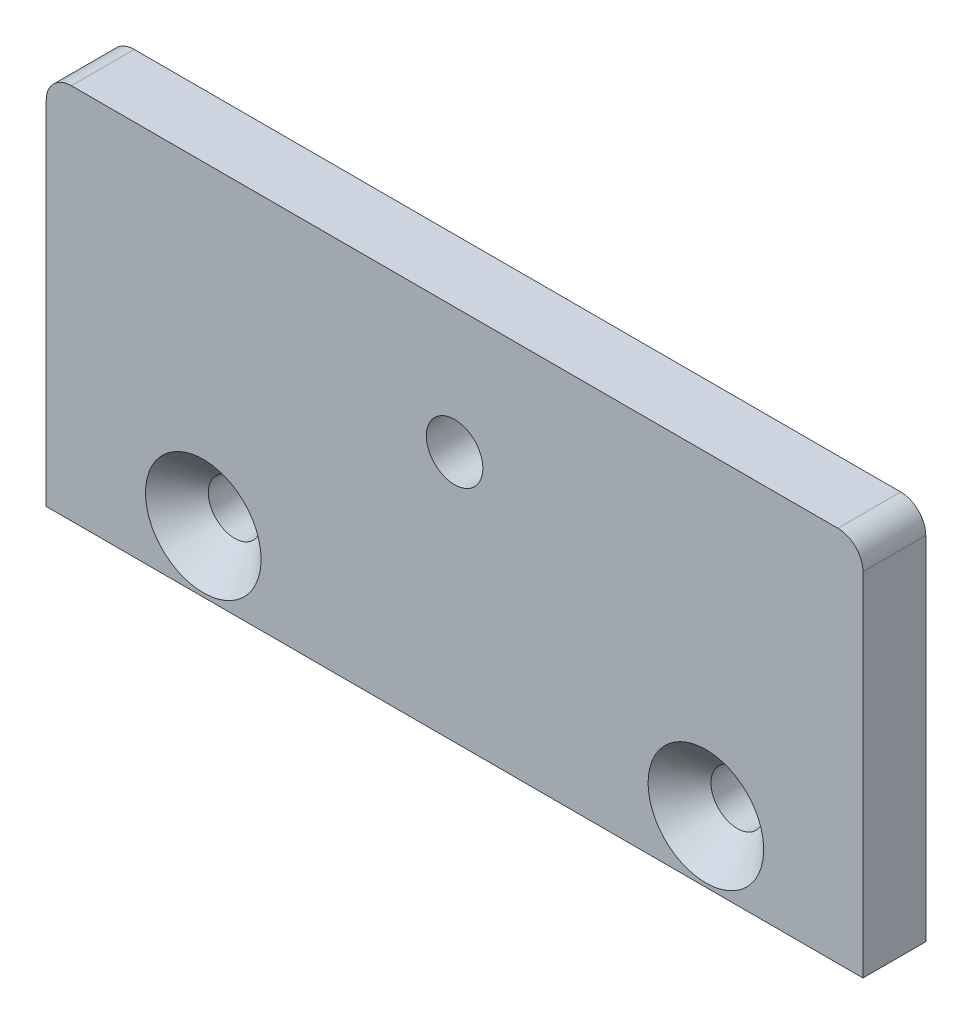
SolidWorks part; units mm, degrees
ref_plane "Plan de face" through (0, 0, 0) normal (0, 0, 1) x (1, 0, 0)
ref_plane "Plan de dessus" through (0, 0, 0) normal (0, 1, 0) x (1, 0, 0)
ref_plane "Plan de droite" through (0, 0, 0) normal (1, 0, 0) x (0, 0, -1)
sketch "Esquisse1" plane through (0, 0, 0) normal (0, 0, 1) x (1, 0, 0)
  line L1 (0, 0) -> (130, 0)
  line L2 (0, 0) -> (0, 60)
  line L3 (0, 60) -> (130, 60)
  line L4 (130, 0) -> (130, 60)
  circle A0 centre (65, 40) radius 4.5
  circle A1 centre (25, 9.8) radius 4.2
  circle A2 centre (105, 9.8) radius 4.2
  dimension "D3" = 9
  dimension "D4" = 65
  dimension "D5" = 20
  dimension "D6" = 8.4
  dimension "D7" = 8.4
  dimension "D8" = 80
  dimension "D9" = 25
  dimension "D10" = 9.8
  dimension "D11" = 9.8
  dimension "D1" = 60
  dimension "D2" = 130
extrude "Boss.-Extru.1" add sketch "Esquisse1" along normal blind 10
chamfer "Chanfrein1" distance 5 angle 45 2 edges at (109.2, 9.8, 10) (29.2, 9.8, 10)
fillet "Congé1" radius 4 2 edges at (130, 60, 5) (0, 60, 5)
